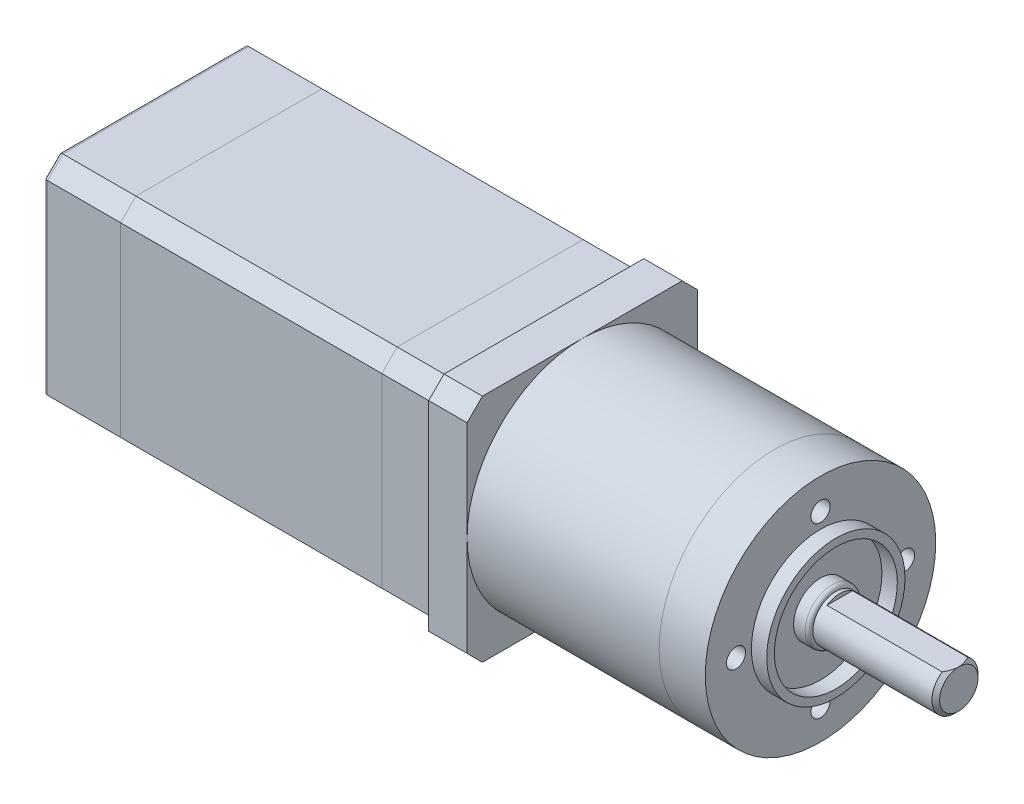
SolidWorks part; units mm, degrees
ref_plane "前视基准面" through (0, 0, 0) normal (0, 0, 1) x (1, 0, 0)
ref_plane "上视基准面" through (0, 0, 0) normal (0, 1, 0) x (1, 0, 0)
ref_plane "右视基准面" through (0, 0, 0) normal (1, 0, 0) x (0, 0, -1)
sketch "草图1" plane through (0, 0, 0) normal (1, 0, 0) x (0, 0, -1)
  circle A0 centre (0, 0) radius 15
extrude "凸台-拉伸1" add sketch "草图1" along normal blind 6
sketch "草图2" plane through (0, 0, 0) normal (-1, 0, 0) x (0, 0, 1)
  circle A0 centre (0, 0) radius 15
extrude "凸台-拉伸2" add sketch "草图2" along normal blind 25 separate body
sketch "草图3" plane through (-25, 0, 0) normal (-1, 0, 0) x (0, 0, 1)
  line L0 (-15, 13) -> (-13, 15)
  line L1 (-13, -15) -> (13, -15)
  line L2 (-15, -13) -> (-15, 13)
  line L3 (-13, 15) -> (13, 15)
  line L4 (15, -13) -> (15, 13)
  line L5 (-15, -15) -> (15, 15) construction
  line L6 (-15, 15) -> (15, -15) construction
  line L7 (13, 15) -> (15, 13)
  line L8 (13, -15) -> (15, -13)
  line L9 (-15, -13) -> (-13, -15)
  point P0 (0, 0)
extrude "凸台-拉伸3" add sketch "草图3" along normal blind 5
sketch "草图4" plane through (-30, 0, 0) normal (-1, 0, 0) x (0, 0, 1)
  line L0 (-14.1, 12.1) -> (-12.1, 14.1)
  line L1 (-12.1, -14.1) -> (12.1, -14.1)
  line L2 (-14.1, -12.1) -> (-14.1, 12.1)
  line L3 (-12.1, 14.1) -> (12.1, 14.1)
  line L4 (14.1, -12.1) -> (14.1, 12.1)
  line L5 (-14.1, -14.1) -> (14.1, 14.1) construction
  line L6 (-14.1, 14.1) -> (14.1, -14.1) construction
  line L7 (12.1, 14.1) -> (14.1, 12.1)
  line L8 (12.1, -14.1) -> (14.1, -12.1)
  line L9 (-14.1, -12.1) -> (-12.1, -14.1)
  point P0 (0, 0)
extrude "凸台-拉伸4" add sketch "草图4" along normal blind 7
sketch "草图5" plane through (-37, 0, 0) normal (-1, 0, 0) x (0, 0, 1)
  line L0 (12.1, 14.1) -> (-12.1, 14.1) construction
  line L1 (-12.1, -14.1) -> (12.1, -14.1)
  line L2 (-14.1, -12.1) -> (-14.1, 12.1)
  line L3 (-12.1, 14.1) -> (12.1, 14.1)
  line L4 (14.1, -12.1) -> (14.1, 12.1)
  line L5 (-14.1, -14.1) -> (14.1, 14.1) construction
  line L6 (-14.1, 14.1) -> (14.1, -14.1) construction
  line L7 (-14.1, 12.1) -> (-12.1, 14.1)
  line L8 (-14.1, -12.1) -> (-12.1, -14.1)
  line L9 (12.1, -14.1) -> (14.1, -12.1)
  line L10 (14.1, 12.1) -> (12.1, 14.1)
  point P0 (0, 0)
extrude "凸台-拉伸5" add sketch "草图5" along normal blind 34 separate body
sketch "草图6" plane through (-71, 0, 0) normal (-1, 0, 0) x (0, 0, 1)
  line L0 (12.1, 14.1) -> (-12.1, 14.1) construction
  line L1 (-12.1, -14.1) -> (12.1, -14.1)
  line L2 (-14.1, -12.1) -> (-14.1, 12.1)
  line L3 (-12.1, 14.1) -> (12.1, 14.1)
  line L4 (14.1, -12.1) -> (14.1, 12.1)
  line L5 (-14.1, -14.1) -> (14.1, 14.1) construction
  line L6 (-14.1, 14.1) -> (14.1, -14.1) construction
  line L7 (-14.1, 12.1) -> (-12.1, 14.1)
  line L8 (-12.1, -14.1) -> (-14.1, -12.1)
  line L9 (12.1, -14.1) -> (14.1, -12.1)
  line L10 (14.1, 12.1) -> (12.1, 14.1)
  point P0 (0, 0)
extrude "凸台-拉伸6" add sketch "草图6" along normal blind 10 separate body
fillet "圆角1" radius 0.5 8 edges at (-81, 14.1, 0) (-81, 13.1, 13.1) (-81, 0, 14.1) (-81, -13.1, 13.1) (-81, -14.1, 0) (-81, -13.1, -13.1) (-81, 0, -14.1) (-81, 13.1, -13.1)
sketch "草图7" plane through (6, 0, 0) normal (1, 0, 0) x (0, 0, -1)
  point P14 (0, 11)
  point P15 (11, 0)
  point P16 (0, -11)
  point P17 (-11, 0)
hole_wizard "M3 螺纹孔1" positions "3D草图1" profile "草图8" tap size "M3" standard "GB"
sketch3d "3D草图1"
  point P0 (6, 11, 0)
  point P3 (6, 0, 11)
  point P6 (6, -11, 0)
  point P9 (6, 0, -11)
sketch "草图8" plane through (6, 11, 0) normal (0, 1, 0) x (0, 0, -1)
  line L0 (0, 0) -> (0, 9.2511)
  line L1 (0, 9.2511) -> (1.25, 8.5)
  line L2 (1.25, 8.5) -> (1.25, 0)
  line L5 (1.25, 0) -> (0, 0)
  line L10 (0, 9.2511) -> (-1.25, 8.5) construction
  line L11 (0, -6.35) -> (0, 107.95) construction
  dimension "螺纹孔钻头直径" = 2.5
  dimension "螺纹孔钻头深度" = 8.5
  dimension "导头角度" = 118
sketch "草图9" plane through (6, 0, 0) normal (1, 0, 0) x (0, 0, -1)
  circle A0 centre (0, 0) radius 9
  circle A1 centre (0, 0) radius 8
extrude "凸台-拉伸7" add sketch "草图9" along normal blind 2 separate body
sketch "草图10" plane through (6, 0, 0) normal (1, 0, 0) x (0, 0, -1)
  circle A0 centre (0, 0) radius 3.5
extrude "凸台-拉伸8" add sketch "草图10" along normal blind 2
fillet "圆角3" radius 0.5 1 edges at (8, 0, -3.5)
sketch "草图12" plane through (8, 0, 0) normal (1, 0, 0) x (0, 0, -1)
  circle A0 centre (0, 0) radius 3
extrude "凸台-拉伸9" add sketch "草图12" along normal blind 16 separate body
sketch "草图13" plane through (24, 0, 0) normal (1, 0, 0) x (0, 0, -1)
  line L2 (1.6583, 2.5) -> (-1.6583, 2.5)
  arc A0 (1.6583, 2.5) -> (-1.6583, 2.5) centre (0, 0) ccw
extrude "切除-拉伸2" cut sketch "草图13" against normal blind 15.5
chamfer "倒角1" distance 0.5 angle 45 1 edges at (24, -3, 0)
